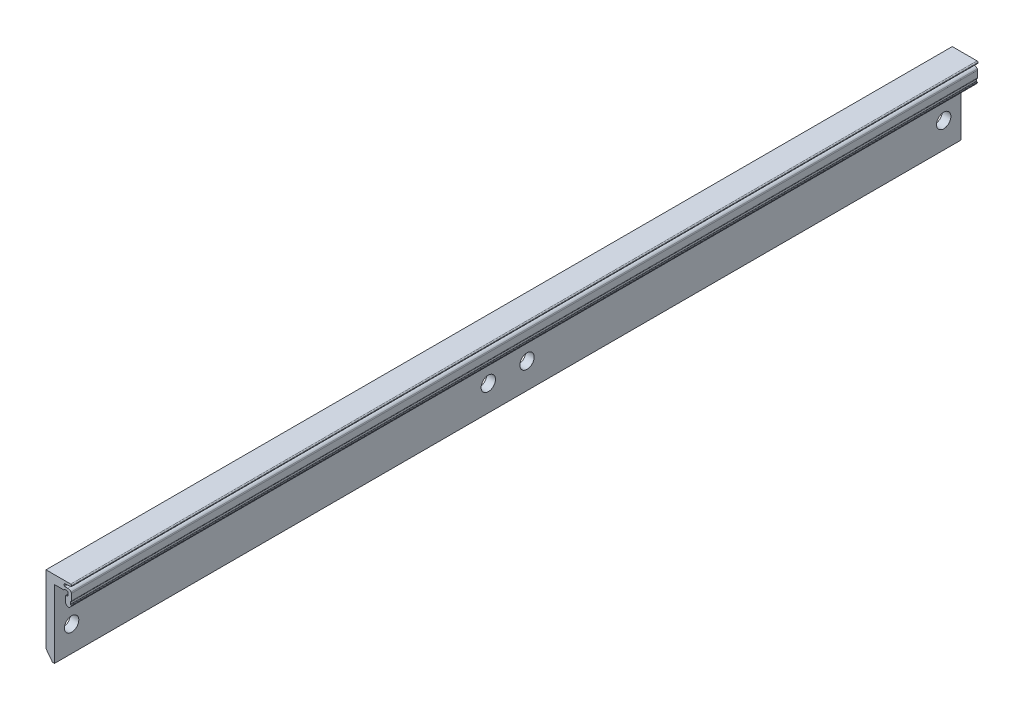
SolidWorks part; units mm, degrees
ref_plane "前视基准面" through (0, 0, 0) normal (0, 0, 1) x (1, 0, 0)
ref_plane "上视基准面" through (0, 0, 0) normal (0, 1, 0) x (1, 0, 0)
ref_plane "右视基准面" through (0, 0, 0) normal (1, 0, 0) x (0, 0, -1)
sketch "草图1" plane through (0, 0, 0) normal (0, 0, 1) x (1, 0, 0)
  line L0 (2350.384, -3290.1038) -> (2355.384, -3290.1038)
  line L2 (2352.884, -3292.6038) -> (2355.384, -3292.6038)
  line L3 (2350.384, -3292.6038) -> (2350.384, -3310.1038)
  line L4 (2352.884, -3292.6038) -> (2352.884, -3312.6038)
  line L5 (2355.384, -3292.6038) -> (2355.384, -3290.1038) construction
  line L6 (2355.384, -3290.1038) -> (2357.924, -3290.1038) construction
  line L7 (2350.384, -3292.6038) -> (2350.384, -3290.1038)
  line L10 (2352.884, -3312.6038) -> (2352.284, -3312.6038)
  line L11 (2350.384, -3310.1038) -> (2352.284, -3312.6038)
  line L12 (2356.524, -3292.3038) -> (2355.988, -3292.3038)
  line L13 (2357.5972, -3295.408) -> (2357.724, -3295.408)
  line L14 (2357.624, -3290.1038) -> (2357.924, -3290.1038) construction
  line L15 (2357.8006, -3295.5917) -> (2357.3831, -3296.0891)
  line L16 (2357.4972, -3294.808) -> (2357.4972, -3295.308)
  line L17 (2357.824, -3295.508) -> (2357.824, -3295.5274)
  line L18 (2357.824, -3292.376) -> (2357.824, -3294.2738)
  line L19 (2356.324, -3293.7038) -> (2356.524, -3293.7038)
  line L20 (2356.024, -3295.4545) -> (2356.024, -3294.0038)
  line L21 (2357.7449, -3290.6914) -> (2355.9031, -3290.8849)
  line L22 (2355.724, -3291.0839) -> (2355.724, -3291.4038)
  line L23 (2355.924, -3291.6038) -> (2356.77, -3291.6038)
  line L24 (2357.924, -3290.4038) -> (2357.924, -3290.4925)
  line L25 (2356.465, -3296.0891) -> (2356.0943, -3295.6474)
  line L26 (2356.824, -3293.4038) -> (2356.824, -3292.6038)
  line L27 (2357.924, -3290.4038) -> (2357.924, -3290.1038) construction
  line L28 (2355.384, -3292.6038) -> (2355.4683, -3292.6038)
  line L29 (2355.384, -3290.1038) -> (2357.624, -3290.1038)
  arc A0 (2357.4972, -3294.808) -> (2357.6606, -3294.5409) centre (2357.7972, -3294.808) cw
  arc A1 (2356.77, -3291.6038) -> (2357.7198, -3292.0704) centre (2356.77, -3292.8038) cw
  arc A2 (2357.824, -3295.5274) -> (2357.8006, -3295.5917) centre (2357.724, -3295.5274) cw
  arc A3 (2355.724, -3291.0839) -> (2355.9031, -3290.8849) centre (2355.924, -3291.0839) cw
  arc A4 (2357.924, -3290.4925) -> (2357.7449, -3290.6914) centre (2357.724, -3290.4925) cw
  arc A5 (2355.7282, -3292.4538) -> (2355.4683, -3292.6038) centre (2355.4683, -3292.3038) cw
  arc A6 (2357.624, -3290.1038) -> (2357.924, -3290.4038) centre (2357.624, -3290.4038) cw
  arc A7 (2357.5972, -3295.408) -> (2357.4972, -3295.308) centre (2357.5972, -3295.308) cw
  arc A8 (2357.824, -3294.2738) -> (2357.6606, -3294.5409) centre (2357.524, -3294.2738) cw
  arc A9 (2355.924, -3291.6038) -> (2355.724, -3291.4038) centre (2355.924, -3291.4038) cw
  arc A10 (2356.524, -3292.3038) -> (2356.824, -3292.6038) centre (2356.524, -3292.6038) cw
  arc A11 (2356.0943, -3295.6474) -> (2356.024, -3295.4545) centre (2356.324, -3295.4545) cw
  arc A12 (2355.7282, -3292.4538) -> (2355.988, -3292.3038) centre (2355.988, -3292.6038) cw
  arc A13 (2357.7198, -3292.0704) -> (2357.824, -3292.376) centre (2357.324, -3292.376) cw
  arc A14 (2356.024, -3294.0038) -> (2356.324, -3293.7038) centre (2356.324, -3294.0038) cw
  arc A15 (2356.824, -3293.4038) -> (2356.524, -3293.7038) centre (2356.524, -3293.4038) cw
  arc A16 (2357.3831, -3296.0891) -> (2356.465, -3296.0891) centre (2356.924, -3295.7038) cw
  arc A17 (2357.724, -3295.408) -> (2357.824, -3295.508) centre (2357.724, -3295.508) cw
  dimension "D1" = 20
  dimension "D2" = 0.6
  dimension "D3" = 2.5
  dimension "D5" = 127.235
extrude "凸台-拉伸1" add sketch "草图1" along normal mid plane 265.35
sketch "草图3" plane through (2350.384, 0, 0) normal (-1, 0, 0) x (0, 0, 1)
  line L0 (-132.675, -3290.1038) -> (-132.675, -3310.1038) construction
  line L1 (132.675, -3290.1038) -> (-132.675, -3290.1038) construction
  line L2 (0, -3290.1038) -> (0, -3328.2905) construction
  circle A0 centre (-127.675, -3305.1038) radius 2.1
  circle A1 centre (127.675, -3305.1038) radius 2.1
  circle A3 centre (-5.675, -3305.1038) radius 2.1
  circle A4 centre (5.675, -3305.1038) radius 2.1
  dimension "D1" = 4.2
  dimension "D2" = 5
  dimension "D3" = 15
  dimension "D5" = 2
  dimension "D8" = 122
  dimension "D9" = 11.35
extrude "切除-拉伸2" cut sketch "草图3" against normal through all
